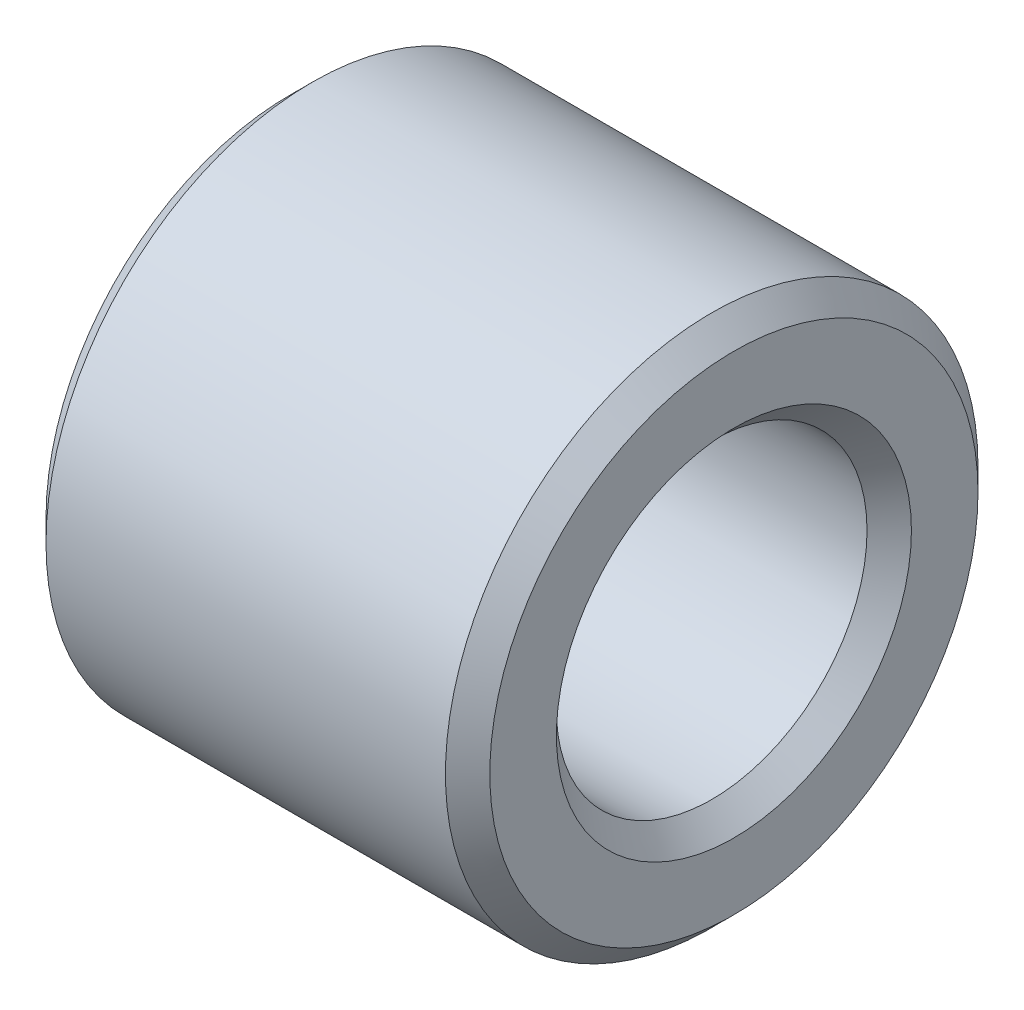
SolidWorks part; units mm, degrees
ref_plane "Plan de face" through (0, 0, 0) normal (0, 0, 1) x (1, 0, 0)
ref_plane "Plan de dessus" through (0, 0, 0) normal (0, 1, 0) x (1, 0, 0)
ref_plane "Plan de droite" through (0, 0, 0) normal (1, 0, 0) x (0, 0, -1)
sketch "Esquisse1" plane through (0, 0, 0) normal (0, 0, 1) x (1, 0, 0)
  line L0 (0, 0) -> (-17.8209, 0) construction
  line L2 (0, 3.5) -> (-10, 3.5)
  line L3 (0, 3.5) -> (0, 6)
  line L4 (0, 6) -> (-10, 6)
  line L5 (-10, 3.5) -> (-10, 6)
  point P7 (-0.5948, 3.5)
  point P8 (0.5618, 3.5)
  point P9 (-0.2904, 3.5)
  dimension "D1" = 7
  dimension "D2" = 12
  dimension "D3" = 10
revolve "Révolution1" add sketch "Esquisse1" angle 360 about L0
chamfer "Chanfrein1" distance 0.5 angle 45 4 edges at (-10, 0, -3.5) (-10, 0, -6) (0, 0, -6) (0, 0, -3.5)
